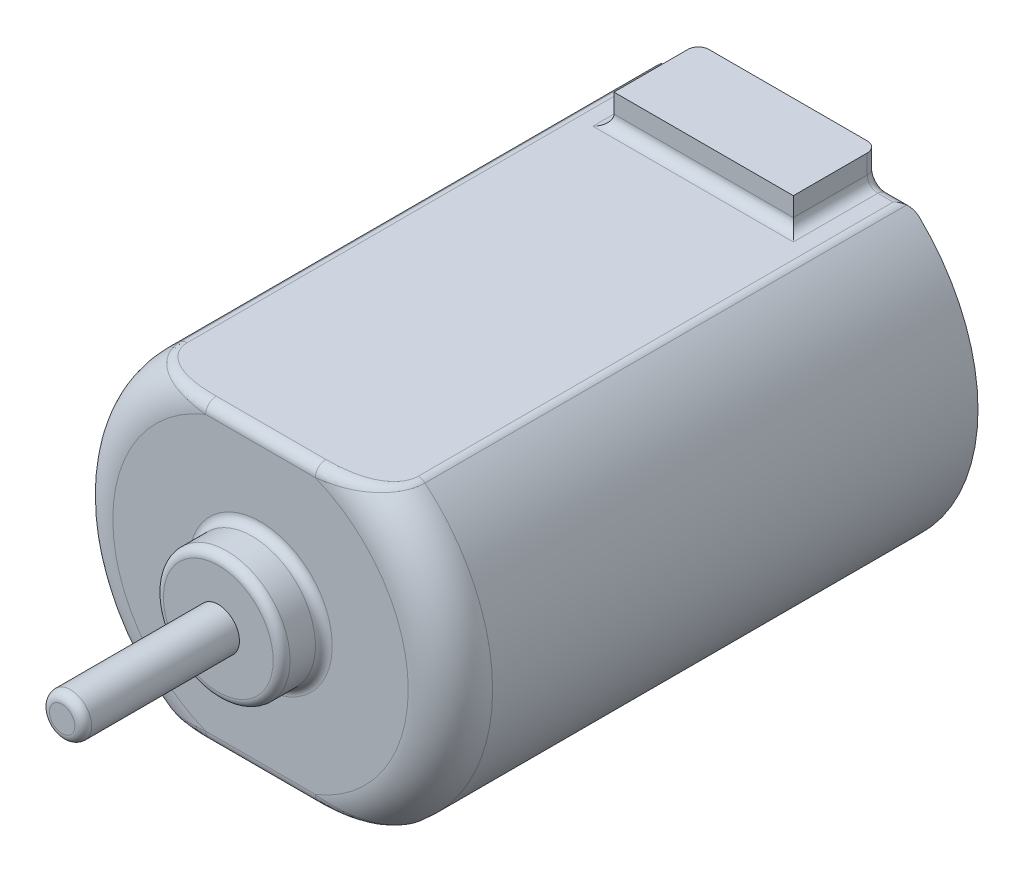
SolidWorks part; units mm, degrees
ref_plane "Front Plane" through (0, 0, 0) normal (0, 0, 1) x (1, 0, 0)
ref_plane "Top Plane" through (0, 0, 0) normal (0, 1, 0) x (1, 0, 0)
ref_plane "Right Plane" through (0, 0, 0) normal (1, 0, 0) x (0, 0, -1)
sketch "Sketch1" plane through (0, 0, 0) normal (0, 0, 1) x (1, 0, 0)
  line L0 (-5.6569, 14) -> (5.6569, 14)
  line L1 (5.6569, 0) -> (-5.6569, 0)
  line L2 (0, 0) -> (0, 14) construction
  line L3 (-5.6569, 14) -> (-5.6569, 0) construction
  arc A0 (5.6569, 14) -> (5.6569, 0) centre (0, 7) cw
  arc A1 (-5.6569, 14) -> (-5.6569, 0) centre (0, 7) ccw
  dimension "D2" = 9
  dimension "D1" = 14
extrude "Boss-Extrude1" add sketch "Sketch1" against normal blind 25
sketch "Sketch2" plane through (0, 0, 0) normal (0, 0, 1) x (1, 0, 0)
  circle A0 centre (0, 7) radius 3
  arc A1 (5.6569, 0) -> (5.6569, 14) centre (0, 7) ccw construction
  dimension "D1" = 6
extrude "Boss-Extrude2" add sketch "Sketch2" along normal blind 2
sketch "Sketch3" plane through (0, 0, 2) normal (0, 0, 1) x (1, 0, 0)
  circle A0 centre (0, 7) radius 1
  circle A1 centre (0, 7) radius 3 construction
  dimension "D1" = 2
extrude "Boss-Extrude3" add sketch "Sketch3" along normal offset from surface (7.4 mm away) 9.4
sketch "Sketch4" plane through (0, 0, -25) normal (0, 0, -1) x (-1, 0, 0)
  line L0 (-3, 3) -> (3, 3)
  arc A0 (3, 3) -> (-3, 3) centre (0, 7) ccw
  arc A1 (5.6569, 0) -> (5.6569, 14) centre (0, 7) ccw construction
  dimension "D2" = 5
  dimension "D1" = 4
extrude "Boss-Extrude4" add sketch "Sketch4" along normal blind 2.3
sketch "Sketch5" plane through (0, 0, -25) normal (0, 0, -1) x (-1, 0, 0)
  line L0 (-5.6569, 14) -> (5.6569, 14) construction
  line L1 (-4.25, 14) -> (4.25, 14)
  line L2 (-4.25, 14) -> (-4.25, 15.4)
  line L3 (-4.25, 15.4) -> (4.25, 15.4)
  line L4 (4.25, 14) -> (4.25, 15.4)
  line L5 (0, 0) -> (0, 21.936) construction
  dimension "D1" = 8.5
  dimension "D2" = 1.4
extrude "Boss-Extrude5" add sketch "Sketch5" against normal blind 4
sketch "Sketch6" plane through (0, 0, -27.3) normal (0, 0, -1) x (-1, 0, 0)
  circle A0 centre (0, 7) radius 1
  arc A1 (3, 3) -> (-3, 3) centre (0, 7) ccw construction
  dimension "D1" = 2
extrude "Boss-Extrude6" add sketch "Sketch6" along normal offset from surface (1.3 mm away) 38
fillet "Fillet1" radius 2 2 edges at (-9, 7, 0) (9, 7, 0)
fillet "Fillet2" radius 0.5 16 edges at (0, 14, -21) (5.6569, 14, -13.5) (5.2495, 14, -1.0312) (-5.3173, 14, -1.1089) (-5.6569, 14, -13.5) (5.3173, 0, -1.1089) (5.6569, 0, -13.5) (0, 0, -25) (-5.6569, 0, -13.5) (-5.2495, 0, -1.0312)
fillet "Fillet4" radius 0.4 6 edges at (-3, 7, 0) (3, 7, 2) (0, 3, -27.3) (0, 3, -25) (0, 12, -25) (0, 12, -27.3)
fillet "Fillet5" radius 0.4 2 edges at (-1, 7, -28.6) (-1, 7, 9.4)
